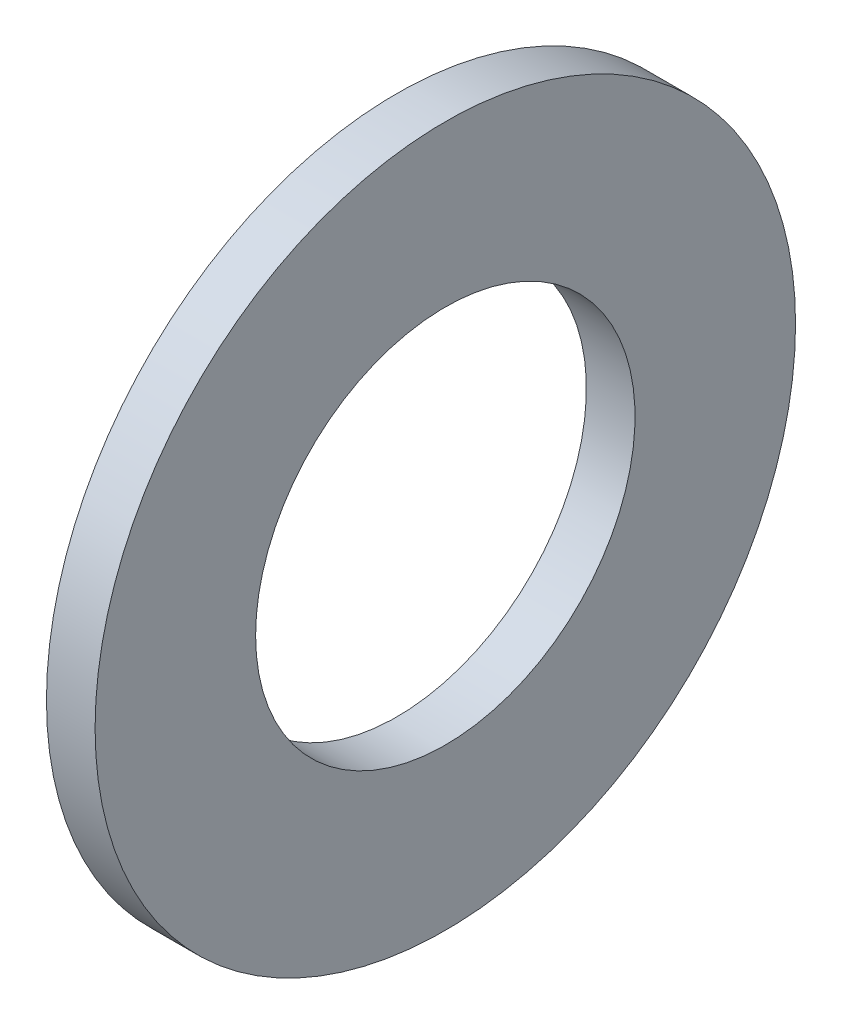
SolidWorks part; units mm, degrees
ref_plane "Plane1" through (0, 0, 0) normal (0, 0, 1) x (1, 0, 0)
ref_plane "Plane2" through (0, 0, 0) normal (0, 1, 0) x (1, 0, 0)
ref_plane "Plane3" through (0, 0, 0) normal (1, 0, 0) x (0, 0, -1)
other "Configuration Table"
sketch "Sketch1" plane through (0, 0, 0) normal (0, 0, 1) x (1, 0, 0)
  line L0 (-34.925, 0) -> (9.525, 0) construction
  line L1 (0, 19.5) -> (0, 36)
  line L2 (0, 36) -> (-5, 36)
  line L3 (-5, 36) -> (-5, 19.5)
  line L4 (-5, 19.5) -> (0, 19.5)
  dimension "Thickness" = 5
  dimension "Inside_dia" = 39
  dimension "Outside_dia" = 72
revolve "Base-Revolve" add sketch "Sketch1" angle 360 about L0
